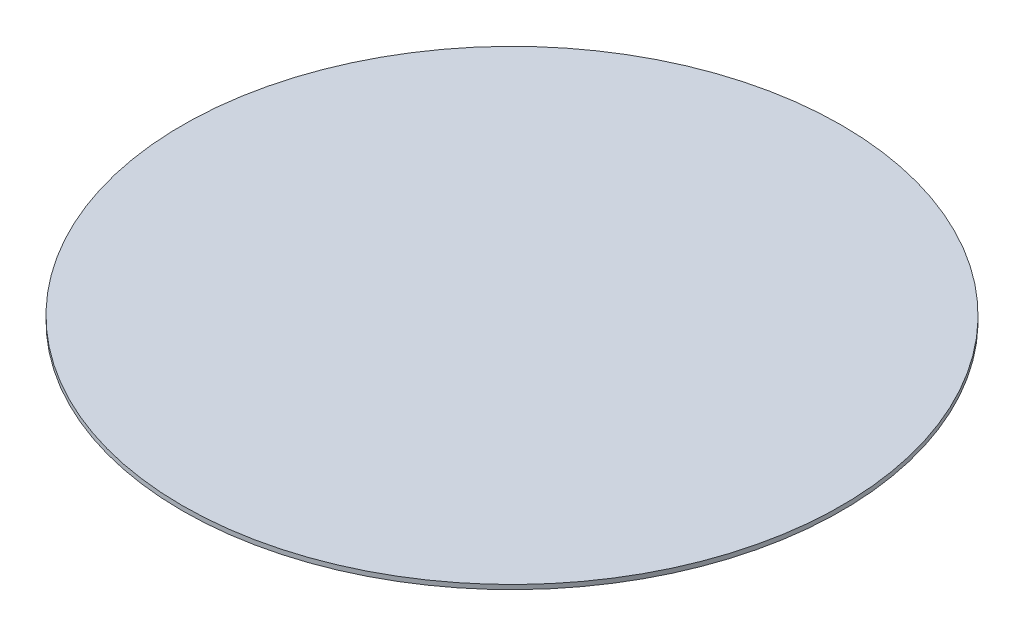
SolidWorks part; units mm, degrees
ref_plane "Alzado" through (0, 0, 0) normal (0, 0, 1) x (1, 0, 0)
ref_plane "Planta" through (0, 0, 0) normal (0, 1, 0) x (1, 0, 0)
ref_plane "Vista lateral" through (0, 0, 0) normal (1, 0, 0) x (0, 0, -1)
sketch "Croquis4" plane through (0, 0, 0) normal (0, 1, 0) x (1, 0, 0)
  circle A0 centre (0, 0) radius 147
  dimension "D1" = 294
extrude "Saliente-Extruir1" add sketch "Croquis4" along normal blind 2
